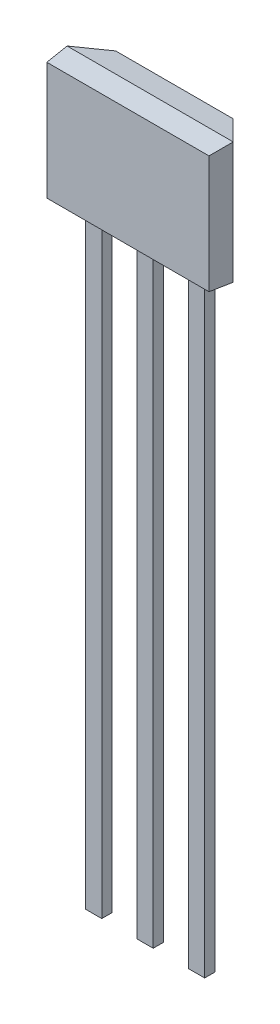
SolidWorks part; units mm, degrees
ref_plane "前基準面" through (0, 0, 0) normal (0, 0, 1) x (1, 0, 0)
ref_plane "上基準面" through (0, 0, 0) normal (0, 1, 0) x (1, 0, 0)
ref_plane "右基準面" through (0, 0, 0) normal (1, 0, 0) x (0, 0, -1)
sketch "草圖1" plane through (0, 0, 0) normal (0, 0, 1) x (1, 0, 0)
  line L1 (-2.05, 1.5) -> (2.05, 1.5)
  line L2 (-2.05, 1.5) -> (-2.05, -1.5)
  line L3 (-2.05, -1.5) -> (2.05, -1.5)
  line L4 (2.05, 1.5) -> (2.05, -1.5)
  line L5 (-2.05, 1.5) -> (2.05, -1.5) construction
  line L6 (-2.05, -1.5) -> (2.05, 1.5) construction
  point P0 (0, 0)
  dimension "D1" = 4.1
  dimension "D2" = 3
extrude "填料-伸長1" add sketch "草圖1" along normal blind 1.15
sketch "草圖2" plane through (0, -1.5, 0) normal (0, -1, 0) x (1, 0, 0)
  line L0 (-2.05, 1.15) -> (-2.05, 0.6)
  line L1 (-2.05, 1.15) -> (-2.05, 0) construction
  line L2 (-2.05, 0.6) -> (-2.0019, 1.15)
  line L3 (-2.05, 1.15) -> (2.05, 1.15) construction
  line L4 (-2.0019, 1.15) -> (-2.05, 1.15)
  line L5 (0, 0) -> (0, 1.15) construction
  line L6 (-2.05, 0.6) -> (-1.45, 0)
  line L7 (-2.05, 0) -> (2.05, 0) construction
  line L8 (-1.45, 0) -> (-2.05, 0)
  line L9 (-2.05, 0) -> (-2.05, 0.6)
  line L10 (2.05, 0) -> (2.05, 0.6)
  line L11 (1.45, 0) -> (2.05, 0)
  line L12 (2.05, 0.6) -> (1.45, 0)
  line L13 (2.0019, 1.15) -> (2.05, 1.15)
  line L14 (2.05, 0.6) -> (2.0019, 1.15)
  line L15 (2.05, 1.15) -> (2.05, 0.6)
  dimension "D1" = 0.55
  dimension "D2" = 5
  dimension "D3" = 45
extrude "除料-伸長1" cut sketch "草圖2" against normal through all contours L6 M10 M7 | L12 M8 M7 | L2 L4 L0 | L14 L13 L15
ref_plane "平面1" through (2.5, 0, 0) normal (1, 0, 0) x (0, 0, -1)
sketch "草圖3" plane through (2.5, 0, 0) normal (1, 0, 0) x (0, 0, -1)
  line L0 (-1.15, -1.5) -> (-0.6, -1.5)
  line L1 (-0.6, -1.5) -> (-1.15, -1.4519)
  line L2 (-1.15, 1.5) -> (-1.15, -1.5) construction
  line L3 (-1.15, -1.4519) -> (-1.15, -1.5)
  line L4 (-0.6, -1.5) -> (0, -1.3942)
  line L5 (0, 1.5) -> (0, -1.5) construction
  line L6 (0, -1.3942) -> (0, -1.5)
  line L7 (0, -1.5) -> (-0.6, -1.5)
  line L8 (0, 0) -> (-1.15, 0) construction
  line L9 (0, 1.5) -> (-0.6, 1.5)
  line L10 (0, 1.3942) -> (0, 1.5)
  line L11 (-0.6, 1.5) -> (0, 1.3942)
  line L12 (-1.15, 1.4519) -> (-1.15, 1.5)
  line L13 (-0.6, 1.5) -> (-1.15, 1.4519)
  line L14 (-1.15, 1.5) -> (-0.6, 1.5)
  dimension "D1" = 5
  dimension "D2" = 10
extrude "除料-伸長2" cut sketch "草圖3" against normal through all contours L7 L6 L4 | L1 L3 L0 | L13 L12 L14 | L11 L10 L9
ref_plane "平面2" through (0, 0, 0.6) normal (0, 0, 1) x (1, 0, 0)
sketch "草圖5" plane through (0, 0, 0.6) normal (0, 0, 1) x (1, 0, 0)
  line L0 (-1.27, -1.5) -> (-1.27, -16.5) construction
  line L1 (-2.05, -1.5) -> (2.05, -1.5) construction
  line L2 (0, -1.5) -> (0, -16.5) construction
  line L3 (1.27, -1.5) -> (1.27, -16.5) construction
  line L5 (-1.47, -1.4) -> (-1.07, -1.4)
  line L6 (-1.47, -1.4) -> (-1.47, -16.6)
  line L7 (-1.47, -16.6) -> (-1.07, -16.6)
  line L8 (-1.07, -1.4) -> (-1.07, -16.6)
  line L9 (-1.47, -1.4) -> (-1.07, -16.6) construction
  line L10 (-1.47, -16.6) -> (-1.07, -1.4) construction
  line L11 (-0.2, -1.4) -> (0.2, -1.4)
  line L12 (-0.2, -1.4) -> (-0.2, -16.6)
  line L13 (-0.2, -16.6) -> (0.2, -16.6)
  line L14 (0.2, -1.4) -> (0.2, -16.6)
  line L15 (-0.2, -1.4) -> (0.2, -16.6) construction
  line L16 (-0.2, -16.6) -> (0.2, -1.4) construction
  line L17 (1.07, -1.4) -> (1.47, -1.4)
  line L18 (1.07, -1.4) -> (1.07, -16.6)
  line L19 (1.07, -16.6) -> (1.47, -16.6)
  line L20 (1.47, -1.4) -> (1.47, -16.6)
  line L21 (1.07, -1.4) -> (1.47, -16.6) construction
  line L22 (1.07, -16.6) -> (1.47, -1.4) construction
  point P9 (0, -9)
  point P10 (-1.27, -9)
  point P19 (1.27, -9)
  dimension "D1" = 1.27
  dimension "D2" = 1.27
  dimension "D3" = 15
  dimension "D4" = 0.4
  dimension "D5" = 0.4
  dimension "D6" = 0.4
  dimension "D7" = 0.1
  dimension "D8" = 0.1
  dimension "D9" = 0.1
extrude "填料-伸長2" add sketch "草圖5" along normal blind 0.125 and the other way blind 0.125 separate body
ref_plane "平面3" through (0, 0, 0.41) normal (0, 0, 1) x (1, 0, 0)
sketch "草圖7" plane through (0, 0, 0.41) normal (0, 0, 1) x (1, 0, 0)
  line L0 (0, 0.79) -> (0, 0) construction
  circle A0 centre (0, 0.79) radius 0.15
  dimension "D2" = 0.3
  dimension "D1" = 0.79
extrude "填料-伸長3" add sketch "草圖7" along normal blind 0.1 separate body
